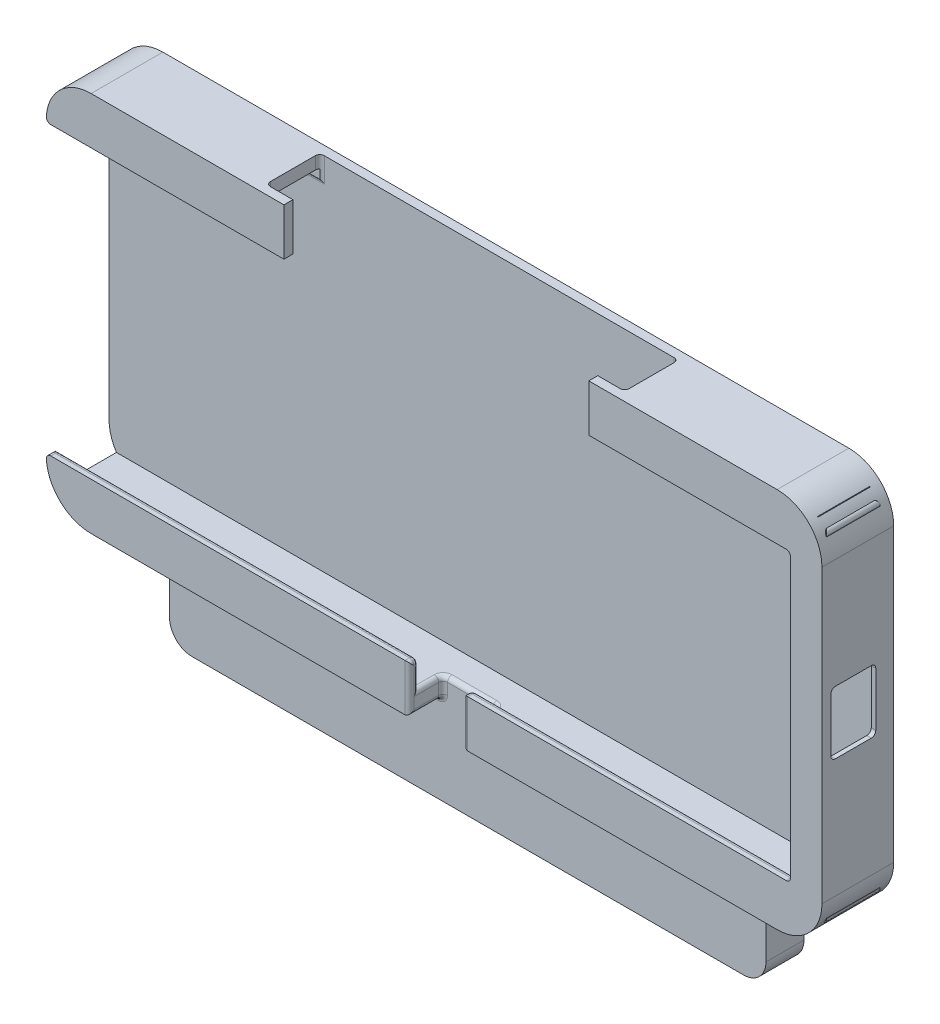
SolidWorks part; units mm, degrees
ref_plane "Alzado" through (0, 0, 0) normal (0, 0, 1) x (1, 0, 0)
ref_plane "Planta" through (0, 0, 0) normal (0, 1, 0) x (1, 0, 0)
ref_plane "Vista lateral" through (0, 0, 0) normal (1, 0, 0) x (0, 0, -1)
sketch "Croquis1" plane through (0, 0, 0) normal (0, 0, 1) x (1, 0, 0)
  line L1 (0, 0) -> (200, 0)
  line L2 (0, 0) -> (0, 85)
  line L3 (0, 85) -> (200, 85)
  line L4 (200, 0) -> (200, 85)
  dimension "D1" = 200
  dimension "D2" = 85
extrude "Saliente-Extruir1" add sketch "Croquis1" along normal blind 16
sketch "Croquis3" plane through (0, 0, 0) normal (0, -1, 0) x (1, 0, 0)
  line L0 (20, 8.5) -> (180, 8.5)
  line L2 (20, 0) -> (20, 8.5)
  line L4 (180, 0) -> (180, 8.5)
  line L8 (20, 0) -> (180, 0)
  line L9 (0, 0) -> (200, 0) construction
  line L10 (100, 0) -> (100, 17) construction
  point P8 (100, 8.5)
  dimension "D1" = 8.5
  dimension "D2" = 160
extrude "Saliente-Extruir2" add sketch "Croquis3" along normal blind 20 contours L2 L0 L4 L8
sketch "Croquis4" plane through (0, 0, 16) normal (0, 0, 1) x (1, 0, 0)
  line L3 (0, -20.8189) -> (200, -20.8189)
  line L4 (200, 65.1788) -> (200, -20.8189)
  line L5 (200, 0) -> (200, 85) construction
  line L6 (0, 85) -> (0, 0) construction
  line L7 (0, 80.5) -> (172, 80.5)
  line L8 (0, 80.5) -> (0, 4.5)
  line L9 (0, 4.5) -> (172, 4.5)
  line L10 (172, 80.5) -> (172, 4.5)
  point P9 (0, 42.5)
  point P12 (0, 42.5)
  point P13 (160.8054, 70.616)
  dimension "D1" = 172
  dimension "D2" = 76
extrude "Cortar-Extruir1" cut sketch "Croquis4" against normal blind 14 contours L10 L7 L9 M9
sketch "Croquis5" plane through (0, 0, 16) normal (0, 0, 1) x (1, 0, 0)
  line L1 (0, 80.5) -> (172, 80.5)
  line L5 (172, 80.5) -> (172, 4.5) construction
  line L6 (172, 4.5) -> (0, 4.5)
  line L10 (0, 80.5) -> (172, 80.5)
  line L11 (0, 80.5) -> (0, 74.5)
  line L12 (0, 74.5) -> (172, 74.5)
  line L13 (172, 80.5) -> (172, 74.5)
  line L15 (172, 4.5) -> (0, 4.5)
  line L16 (172, 4.5) -> (172, 10.5)
  line L17 (172, 10.5) -> (0, 10.5)
  line L18 (0, 4.5) -> (0, 10.5)
  line L19 (172, 74.5) -> (166, 74.5)
  line L20 (172, 74.5) -> (172, 10.5)
  line L21 (172, 10.5) -> (166, 10.5)
  line L22 (166, 74.5) -> (166, 10.5)
  dimension "D1" = 6
  dimension "D2" = 172
  dimension "D3" = 6
  dimension "D4" = 6
extrude "Saliente-Extruir3" add sketch "Croquis5" against normal blind 2 contours L11 L12 M9 M16 | L18 L17 M10 M9 | L20 L19 L22 L21
sketch "Croquis6" plane through (0, 0, 16) normal (0, 0, 1) x (1, 0, 0)
  line L0 (200, 85) -> (0, 85) construction
  line L1 (200, 85) -> (173, 85)
  line L2 (200, 85) -> (200, 0)
  line L3 (200, 0) -> (173, 0)
  line L4 (173, 85) -> (173, 0)
  line L5 (200, 0) -> (200, 85) construction
  line L6 (0, 0) -> (200, 0) construction
  line L7 (166, 74.5) -> (166, 10.5) construction
  line L8 (20, -20) -> (180, -20) construction
  line L9 (180, 0) -> (153, 0)
  line L10 (180, 0) -> (180, -20)
  line L11 (180, -20) -> (153, -20)
  line L12 (153, 0) -> (153, -20)
  line L13 (180, -20) -> (180, 0) construction
  dimension "D1" = 7
  dimension "D2" = 27
extrude "Cortar-Extruir3" cut sketch "Croquis6" against normal through all contours L2 L1 L4 L3 | L10 L9 L12 L11
sketch "Croquis7" plane through (0, 0, 16) normal (0, 0, 1) x (1, 0, 0)
  line L0 (173, 85) -> (0, 85) construction
  line L1 (47, 85) -> (127, 85)
  line L2 (47, 85) -> (47, 74.5)
  line L3 (47, 74.5) -> (127, 74.5)
  line L4 (127, 85) -> (127, 74.5)
  line L5 (0, 74.5) -> (166, 74.5) construction
  line L6 (173, 85) -> (173, 0) construction
  dimension "D1" = 80
  dimension "D2" = 46
extrude "Cortar-Extruir4" cut sketch "Croquis7" against normal up to surface (14 mm away)
sketch "Croquis9" plane through (0, 85, 0) normal (0, 1, 0) x (1, 0, 0)
  line L1 (47, -16) -> (53, -16)
  line L2 (47, -16) -> (47, -14)
  line L3 (47, -14) -> (53, -14)
  line L4 (53, -16) -> (53, -14)
  line L5 (127, -16) -> (121, -16)
  line L6 (127, -16) -> (127, -14)
  line L7 (127, -14) -> (121, -14)
  line L8 (121, -16) -> (121, -14)
  dimension "D1" = 2
  dimension "D2" = 2
  dimension "D3" = 6
  dimension "D4" = 6
extrude "Saliente-Extruir4" add sketch "Croquis9" against normal up to surface (10.5 mm away)
fillet "Redondeo2" radius 1 17 edges at (149.5, 80.5, 14) (149.5, 80.5, 2) (127, 80.5, 8) (127, 82.75, 2) (47, 82.75, 2) (47, 82.75, 14) (127, 82.75, 14) (172, 80.5, 8) (172, 4.5, 8) (23.5, 80.5, 2) (0, 74.5, 15) (23.5, 80.5, 14) (166, 74.5, 15) (83, 10.5, 14) (0, 10.5, 15) (166, 42.5, 14) (166, 10.5, 15)
fillet "Redondeo3" radius 5 2 edges at (20, -20, 4.25) (153, -20, 4.25)
sketch "Croquis12" plane through (0, 0, 0) normal (-1, 0, 0) x (0, 0, 1)
  line L1 (2.2929, 80.2071) -> (13.9147, 80.2071)
  line L2 (2.2929, 80.2071) -> (2.2929, 82.2071)
  line L3 (2.2929, 82.2071) -> (13.9147, 82.2071)
  line L4 (13.9147, 80.2071) -> (13.9147, 82.2071)
  arc A0 (3, 80.5) -> (2, 79.5) centre (3, 79.5) ccw construction
  dimension "D1" = 2
extrude "Cortar-Extruir6" cut sketch "Croquis12" against normal blind 170
fillet "Redondeo1" radius 10 4 edges at (173, 0, 8) (0, 0, 8) (173, 85, 8) (0, 85, 8)
sketch "Croquis10" plane through (173, 0, 0) normal (1, 0, 0) x (0, 0, -1)
  line L0 (-14, 50.5) -> (-4, 50.5)
  line L6 (-8, 75) -> (-8, 35.5) construction
  line L7 (0, 75) -> (-16, 75) construction
  line L13 (0, 51.5) -> (0, 35.5) construction
  line L14 (-14, 36.5) -> (-4, 36.5)
  line L15 (-14, 50.5) -> (-14, 36.5)
  line L16 (-1, 50.5) -> (-1, 36.5) construction
  line L17 (-4, 50.5) -> (-4, 36.5)
  line L18 (-15, 51.5) -> (0, 51.5) construction
  line L19 (-14, 50.5) -> (-1, 50.5) construction
  line L20 (-14, 36.5) -> (-1, 36.5) construction
  line L21 (-15, 35.5) -> (0, 35.5) construction
  line L22 (-15, 51.5) -> (-15, 35.5) construction
  dimension "D1" = 14
  dimension "D3" = 4
  dimension "D2" = 1
extrude "Cortar-Extruir5" cut sketch "Croquis10" against normal blind 12
sketch "Croquis14" plane through (0, 0, 0) normal (0, -1, 0) x (1, 0, 0)
  line L0 (48, 2) -> (126, 2) construction
  line L1 (48, 2) -> (126, 2) construction
  line L2 (25, 8.5) -> (148, 8.5) construction
  line L3 (81, 16) -> (93, 16)
  line L4 (81, 16) -> (81, 2)
  line L5 (81, 2) -> (93, 2)
  line L6 (93, 16) -> (93, 2)
  line L7 (48, 8.5) -> (126, 8.5)
  line L8 (48, 2) -> (48, 32.2839) construction
  line L9 (126, 2) -> (126, 32.2839) construction
  line L10 (10, 16) -> (163, 16) construction
  line L11 (48, 16) -> (126, 16)
  line L12 (87, 16) -> (87, -17.0785) construction
  line L13 (127, 3) -> (127, 13) construction
  line L14 (47, 13) -> (47, 3) construction
  line L15 (127, 3) -> (127, 13) construction
  line L16 (47, 13) -> (47, 3) construction
  line L17 (47, 13) -> (127, 13) construction
  point P6 (87, 2)
  point P17 (87, 16)
  dimension "D1" = 12
extrude "Cortar-Extruir7" cut sketch "Croquis14" against normal blind 170 contours L6 L4 M12 M16
fillet "Redondeo4" radius 1 17 edges at (50.5, 0, 8.5) (81, 10.2071, 14.2929) (93, 10.2071, 14.2929) (123, 0, 8.5) (87, 4.5, 8.5) (93, 2.25, 8.5) (93, 10.5, 15.5) (93, 5.25, 16) (93, 0, 12.25) (81, 7, 14) (81, 4.5, 11.25) (81, 2.25, 8.5) (93, 7, 14) (93, 4.5, 11.25) (81, 10.5, 15.5) (81, 5.25, 16) (81, 0, 12.25)
fillet "Redondeo5" radius 1 4 edges at (172.5, 36.5, 4) (172.5, 36.5, 14) (172.5, 50.5, 4) (172.5, 50.5, 14)
